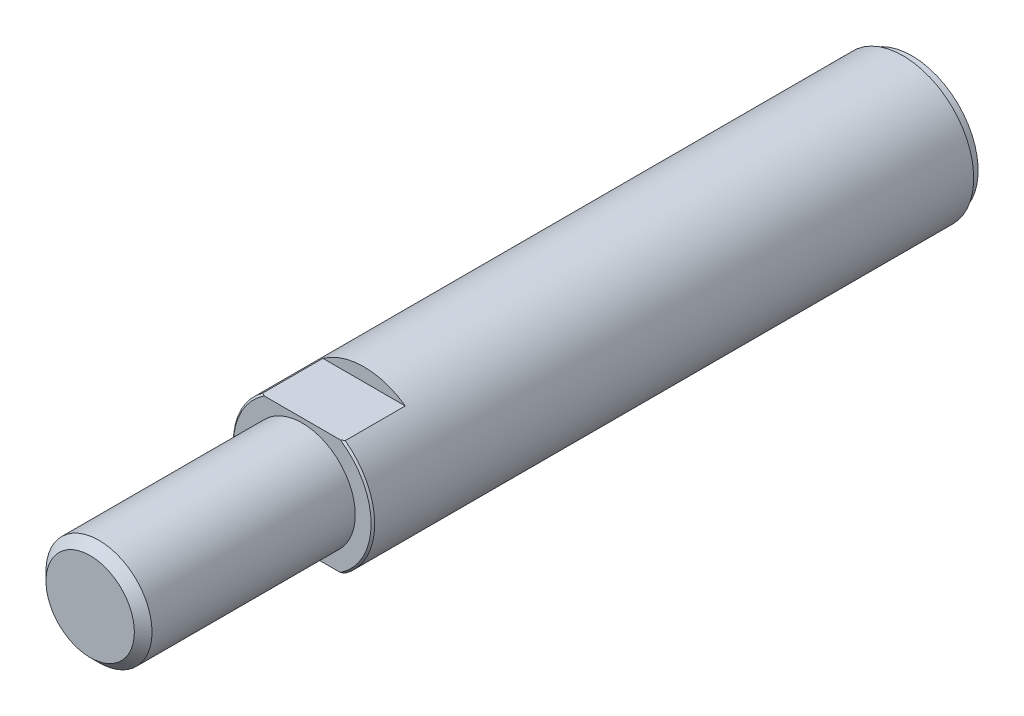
SolidWorks part; units mm, degrees
ref_plane "Plano frontal" through (0, 0, 0) normal (0, 0, 1) x (1, 0, 0)
ref_plane "Plano superior" through (0, 0, 0) normal (0, 1, 0) x (1, 0, 0)
ref_plane "Plano direito" through (0, 0, 0) normal (1, 0, 0) x (0, 0, -1)
sketch "Esboço1" plane through (0, 0, 0) normal (0, 0, 1) x (1, 0, 0)
  circle A0 centre (0, 0) radius 8
  dimension "D1" = 16
extrude "Ressalto-extrusão1" add sketch "Esboço1" along normal blind 93
sketch "Esboço2" plane through (0, 0, 93) normal (0, 0, 1) x (1, 0, 0)
  circle A0 centre (0, 0) radius 6
  dimension "D1" = 12
extrude "Corte-extrusão1" cut sketch "Esboço2" against normal blind 24 flip side to cut
hole_wizard "Furo roscado de M8x1.251" positions "Esboço3" profile "Esboço4" tap size "M8x1.25" standard "Ansi Metric"
sketch "Esboço3" plane through (0, 0, 0) normal (0, 0, -1) x (-1, 0, 0)
  point P0 (0, 0)
sketch "Esboço4" plane through (0, 0, 0) normal (1, 0, 0) x (0, 1, 0)
  line L0 (0, 0) -> (0, 24.2929)
  line L1 (0, 24.2929) -> (3.4, 22.25)
  line L2 (3.4, 22.25) -> (3.4, 0)
  line L5 (3.4, 0) -> (0, 0)
  line L10 (0, 24.2929) -> (-3.4, 22.25) construction
  line L11 (0, -6.35) -> (0, 107.95) construction
  dimension "Tap Drill Dia." = 6.8
  dimension "Tap Drill Depth" = 22.25
  dimension "Drill Angle" = 118
sketch "Esboço5" plane through (0, 0, 69) normal (0, 0, 1) x (1, 0, 0)
  line L1 (-13.7678, -6.5) -> (13.7678, -6.5)
  line L2 (-13.7678, -6.5) -> (-13.7678, 6.5)
  line L3 (-13.7678, 6.5) -> (13.7678, 6.5)
  line L4 (13.7678, -6.5) -> (13.7678, 6.5)
  line L5 (-13.7678, -6.5) -> (13.7678, 6.5) construction
  line L6 (-13.7678, 6.5) -> (13.7678, -6.5) construction
  point P0 (0, 0)
  dimension "D1" = 13
extrude "Corte-extrusão2" cut sketch "Esboço5" against normal blind 7 flip side to cut
chamfer "Chanfro1" distance 0.2 angle 45 2 edges at (-8, 0, 69) (8, 0, 69)
chamfer "Chanfro2" distance 1 angle 45 1 edges at (6, 0, 93)
sketch "Esboço6" plane through (0, 0, 0) normal (0, 0, -1) x (-1, 0, 0)
  circle A0 centre (0, 0) radius 7.5
  dimension "D1" = 15
extrude "Corte-extrusão3" cut sketch "Esboço6" against normal blind 1 flip side to cut
